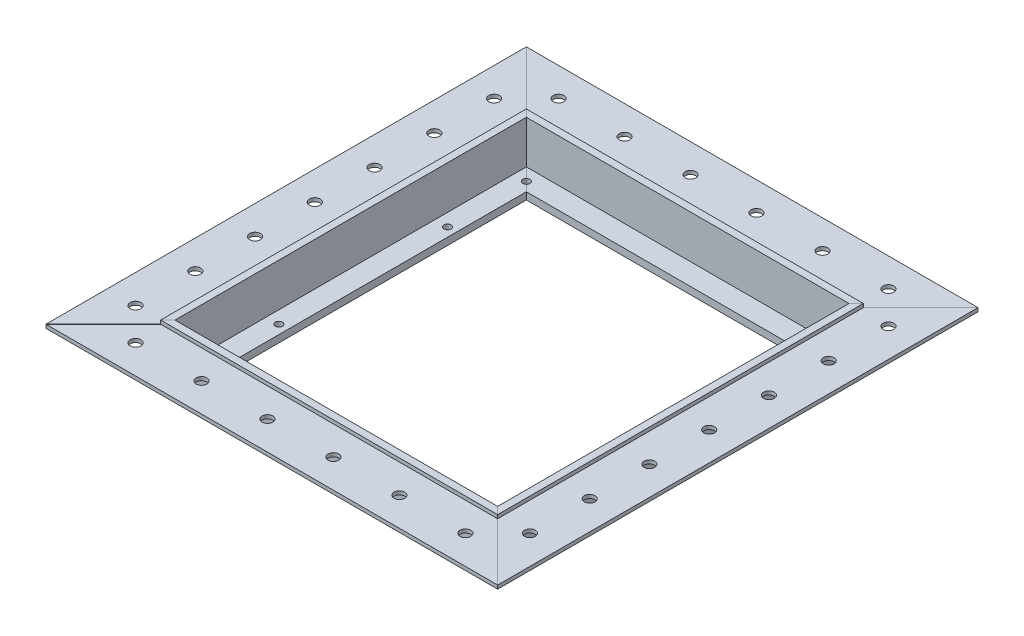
SolidWorks part; units mm, degrees
ref_plane "Front Plane" through (0, 0, 0) normal (0, 0, 1) x (1, 0, 0)
ref_plane "Top Plane" through (0, 0, 0) normal (0, 1, 0) x (1, 0, 0)
ref_plane "Right Plane" through (0, 0, 0) normal (1, 0, 0) x (0, 0, -1)
sketch "Sketch1" plane through (0, 0, 0) normal (0, 0, 1) x (1, 0, 0)
  line L0 (0, 0) -> (-12.7, 0)
  line L1 (-12.7, 0) -> (-12.7, 19.05)
  line L2 (-12.7, 19.05) -> (-38.1, 19.05)
  line L3 (-38.1, 19.05) -> (-38.1, 20.6375)
  line L4 (-38.1, 20.6375) -> (-12.7, 20.6375)
  line L5 (-12.7, 20.6375) -> (-12.7, 22.225)
  line L6 (-12.7, 22.225) -> (-9.525, 22.225)
  line L7 (-9.525, 22.225) -> (-9.525, 3.175)
  line L8 (-9.525, 3.175) -> (0, 3.175)
  line L9 (0, 3.175) -> (0, 0)
  line L10 (0, 0) -> (0.1482, 0.0676)
  line L11 (-9.525, 22.225) -> (133.35, 22.225) construction
  line L12 (61.9125, 22.225) -> (61.9125, -3.6466) construction
  line L13 (123.825, 0) -> (123.6768, 0.0676)
  line L14 (123.825, 3.175) -> (123.825, 0)
  line L15 (133.35, 3.175) -> (123.825, 3.175)
  line L16 (133.35, 22.225) -> (133.35, 3.175)
  line L17 (136.525, 22.225) -> (133.35, 22.225)
  line L18 (136.525, 20.6375) -> (136.525, 22.225)
  line L19 (161.925, 20.6375) -> (136.525, 20.6375)
  line L20 (161.925, 19.05) -> (161.925, 20.6375)
  line L21 (136.525, 19.05) -> (161.925, 19.05)
  line L22 (136.525, 0) -> (136.525, 19.05)
  line L23 (123.825, 0) -> (136.525, 0)
  dimension "D1" = 12.7
  dimension "D2" = 19.05
  dimension "D3" = 25.4
  dimension "D4" = 1.5875
  dimension "D5" = 22.225
  dimension "D6" = 3.175
  dimension "D7" = 3.175
  dimension "D8" = 142.875
sketch "Sketch2" plane through (0, 0, 0) normal (0, 1, 0) x (1, 0, 0)
  line L0 (-9.525, 0) -> (133.35, 0) construction
  line L1 (150.8125, -47.625) -> (-26.9875, -47.625)
  line L2 (150.8125, -47.625) -> (150.8125, 47.625)
  line L3 (150.8125, 47.625) -> (-26.9875, 47.625)
  line L4 (-26.9875, -47.625) -> (-26.9875, 47.625)
  line L5 (150.8125, -47.625) -> (-26.9875, 47.625) construction
  line L6 (150.8125, 47.625) -> (-26.9875, -47.625) construction
  point P0 (61.9125, 0)
  dimension "D1" = 177.8
  dimension "D2" = 95.25
extrude "Boss-Extrude1" add sketch "Sketch1" along normal mid plane 155.575 contours L14 L23 L22 L21 L20 L19 L18 L17 L16 L15 | L0 L1 L2 L3 L4 L5 L6 L7 L8 L9
ref_plane "Plane2" through (61.9125, 0, 0) normal (-1, 0, 0) x (0, 0, 1)
sketch "Sketch3" plane through (61.9125, 0, 0) normal (-1, 0, 0) x (0, 0, 1)
  line L0 (-68.2625, 0) -> (-80.9625, 0)
  line L1 (-80.9625, 0) -> (-80.9625, 19.05)
  line L2 (-80.9625, 19.05) -> (-106.3625, 19.05)
  line L3 (-106.3625, 19.05) -> (-106.3625, 20.6375)
  line L4 (-106.3625, 20.6375) -> (-80.9625, 20.6375)
  line L5 (-80.9625, 20.6375) -> (-80.9625, 22.225)
  line L6 (-80.9625, 22.225) -> (-77.7875, 22.225)
  line L7 (-77.7875, 22.225) -> (-77.7875, 3.175)
  line L8 (-77.7875, 3.175) -> (-68.2625, 3.175)
  line L9 (-68.2625, 3.175) -> (-68.2625, 0)
  line L11 (0, 22.225) -> (0, -35.0713) construction
  line L12 (77.7875, 22.225) -> (-77.7875, 22.225) construction
  line L13 (68.2625, 0) -> (68.1143, 0.0676)
  line L14 (68.2625, 3.175) -> (68.2625, 0)
  line L15 (77.7875, 3.175) -> (68.2625, 3.175)
  line L16 (77.7875, 22.225) -> (77.7875, 3.175)
  line L17 (80.9625, 22.225) -> (77.7875, 22.225)
  line L18 (80.9625, 20.6375) -> (80.9625, 22.225)
  line L19 (106.3625, 20.6375) -> (80.9625, 20.6375)
  line L20 (106.3625, 19.05) -> (106.3625, 20.6375)
  line L21 (80.9625, 19.05) -> (106.3625, 19.05)
  line L22 (80.9625, 0) -> (80.9625, 19.05)
  line L23 (68.2625, 0) -> (80.9625, 0)
  dimension "D1" = 12.7
  dimension "D2" = 19.05
  dimension "D3" = 25.4
  dimension "D4" = 1.5875
  dimension "D5" = 22.225
  dimension "D6" = 3.175
  dimension "D7" = 3.175
  dimension "D8" = 77.7875
extrude "Boss-Extrude2" add sketch "Sketch3" along normal mid plane 200.025 contours L9 L8 L7 L6 L5 L4 L3 L2 L1 L0 | L14 L23 L22 L21 L20 L19 L18 L17 L16 L15
sketch "Sketch4" plane through (0, 20.6375, 0) normal (0, 1, 0) x (1, 0, 0)
  line L0 (-38.1, -106.3625) -> (161.925, -106.3625) construction
  line L1 (161.925, 106.3625) -> (136.525, 106.3625)
  line L2 (161.925, 106.3625) -> (161.925, -106.3625)
  line L3 (161.925, -106.3625) -> (136.525, -106.3625)
  line L4 (136.525, 106.3625) -> (136.525, -106.3625)
  line L5 (-38.1, 106.3625) -> (161.925, 106.3625) construction
  line L6 (-38.1, -106.3625) -> (-12.7, -106.3625)
  line L7 (-38.1, -106.3625) -> (-38.1, 106.3625)
  line L8 (-38.1, 106.3625) -> (-12.7, 106.3625)
  line L9 (-12.7, -106.3625) -> (-12.7, 106.3625)
  line L10 (136.525, -77.7875) -> (136.525, 77.7875) construction
  line L11 (161.925, -77.7875) -> (161.925, 77.7875) construction
  line L12 (-38.1, -106.3625) -> (161.925, -106.3625) construction
  line L13 (-12.7, -77.7875) -> (-12.7, 77.7875) construction
  line L14 (-38.1, 106.3625) -> (161.925, 106.3625) construction
  line L15 (-38.1, -77.7875) -> (-38.1, 77.7875) construction
  point P14 (120.65, 117.475)
  point P19 (0, 0)
extrude "Cut-Extrude1" cut sketch "Sketch4" along normal blind 158.75
sketch "Sketch5" plane through (0, 0, 80.9625) normal (0, 0, 1) x (1, 0, 0)
  line L1 (-38.1, 19.05) -> (-12.7, 19.05)
  line L2 (-38.1, 19.05) -> (-38.1, 0)
  line L3 (-38.1, 0) -> (-12.7, 0)
  line L4 (-12.7, 19.05) -> (-12.7, 0)
  line L5 (136.525, 0) -> (161.925, 0)
  line L6 (136.525, 0) -> (136.525, 19.05)
  line L7 (136.525, 19.05) -> (161.925, 19.05)
  line L8 (161.925, 0) -> (161.925, 19.05)
extrude "Cut-Extrude2" cut sketch "Sketch5" against normal through all
sketch "Sketch14" plane through (0, 22.225, 0) normal (0, 1, 0) x (1, 0, 0)
  line L0 (-9.525, -77.7875) -> (133.35, -77.7875) construction
  line L1 (133.35, -77.7875) -> (133.35, 77.7875) construction
  line L2 (-9.525, 77.7875) -> (133.35, 77.7875) construction
  line L3 (-9.525, -77.7875) -> (-9.525, 77.7875) construction
  line L4 (-12.7, 80.9625) -> (-12.7, -80.9625)
  line L5 (-12.7, -80.9625) -> (136.525, -80.9625)
  line L6 (136.525, -80.9625) -> (136.525, 80.9625)
  line L7 (136.525, 80.9625) -> (-12.7, 80.9625)
  line L8 (-12.7, 80.9625) -> (-12.7, -80.9625)
  line L9 (-12.7, -80.9625) -> (136.525, -80.9625)
  line L10 (136.525, -80.9625) -> (136.525, 80.9625)
  line L11 (136.525, 80.9625) -> (-12.7, 80.9625)
  line L12 (-9.525, -77.7875) -> (133.35, -77.7875)
  line L13 (133.35, -77.7875) -> (133.35, 77.7875)
  line L14 (-9.525, 77.7875) -> (133.35, 77.7875)
  line L15 (-9.525, -77.7875) -> (-9.525, 77.7875)
  line L16 (-11.1125, -79.375) -> (-11.1125, 79.375)
  line L17 (-11.1125, 79.375) -> (134.9375, 79.375)
  line L18 (134.9375, -79.375) -> (134.9375, 79.375)
  line L19 (-11.1125, -79.375) -> (134.9375, -79.375)
  dimension "D2" = 1.5875
  dimension "D1" = 0
sketch "Sketch6" plane through (0, 22.225, 0) normal (0, 1, 0) x (1, 0, 0)
  line L0 (161.925, 106.3625) -> (123.825, 68.2625) construction
  line L1 (0, 0) -> (186.3821, 0) construction
  line L2 (61.9125, 106.3625) -> (61.9125, 211.7305) construction
  line L3 (-38.1, 106.3625) -> (161.925, 106.3625) construction
  line L4 (161.907, 106.3805) -> (114.639, 59.1124)
  line L5 (161.943, 106.3445) -> (115.0327, 59.4343)
  line L6 (114.639, 59.1124) -> (115.0327, 59.4343)
  line L7 (161.907, 106.3805) -> (123.807, 68.2805) construction
  line L8 (161.943, 106.3445) -> (123.843, 68.2445) construction
  line L9 (161.907, 106.3805) -> (161.943, 106.3445)
  line L10 (-38.1, 106.3625) -> (0, 68.2625) construction
  line L11 (-38.082, 106.3805) -> (-38.118, 106.3445)
  line L12 (9.186, 59.1124) -> (8.7923, 59.4343)
  line L13 (-38.118, 106.3445) -> (8.7923, 59.4343)
  line L14 (-38.082, 106.3805) -> (9.186, 59.1124)
  line L15 (-38.1, -106.3625) -> (0, -68.2625) construction
  line L16 (61.9125, -106.3625) -> (61.9125, -211.7305) construction
  line L17 (161.925, -106.3625) -> (123.825, -68.2625) construction
  line L18 (-38.082, -106.3805) -> (9.186, -59.1124)
  line L19 (-38.118, -106.3445) -> (8.7923, -59.4343)
  line L20 (9.186, -59.1124) -> (8.7923, -59.4343)
  line L21 (-38.082, -106.3805) -> (-38.118, -106.3445)
  line L22 (161.907, -106.3805) -> (161.943, -106.3445)
  line L23 (114.639, -59.1124) -> (115.0327, -59.4343)
  line L24 (161.943, -106.3445) -> (115.0327, -59.4343)
  line L25 (161.907, -106.3805) -> (114.639, -59.1124)
  dimension "D3" = 1.27
  dimension "D4" = 0.5085
  dimension "D1" = 0.0254
  dimension "D2" = 0.0254
extrude "Cut-Extrude3" cut sketch "Sketch6" against normal through all
sketch "Sketch7" plane through (0, 20.6375, 0) normal (0, 1, 0) x (1, 0, 0)
  line L0 (-38.1, 106.3266) -> (-38.1, 106.3625) construction
  line L1 (-38.1, 106.3625) -> (-38.0641, 106.3625) construction
  line L2 (161.8891, -106.3625) -> (161.925, -106.3625) construction
  line L3 (161.925, -106.3266) -> (161.925, -106.3625) construction
  line L4 (149.225, 93.6625) -> (-25.4, 93.6625) construction
  line L5 (161.925, -106.3625) -> (-38.1, -106.3625) construction
  line L6 (161.925, -106.3625) -> (161.925, 106.3625) construction
  line L7 (161.925, 106.3625) -> (-38.1, 106.3625) construction
  line L8 (-38.1, -106.3625) -> (-38.1, 106.3625) construction
  line L9 (-25.4, -93.6625) -> (-25.4, 93.6625) construction
  line L10 (149.225, -93.6625) -> (-25.4, -93.6625) construction
  line L11 (149.225, -93.6625) -> (149.225, 93.6625) construction
  line L12 (-12.7, 75.2116) -> (-9.525, 75.2116) construction
  line L13 (-12.7, -80.9266) -> (-12.7, 80.9266) construction
  line L14 (-9.525, -77.7516) -> (-9.525, 77.7516) construction
  line L15 (-6.9491, 80.9625) -> (-6.9491, 77.7875) construction
  line L16 (-12.6641, 80.9625) -> (136.4891, 80.9625) construction
  line L17 (133.3141, 77.7875) -> (-9.4891, 77.7875) construction
  line L18 (61.9125, 106.3625) -> (61.9125, -106.3625) construction
  line L19 (-38.1, 0) -> (161.925, 0) construction
  line L20 (-11.1125, 75.2116) -> (-11.1125, 93.6625) construction
  line L21 (-6.9491, 79.375) -> (-25.4, 79.375) construction
  line L22 (130.7741, 80.9625) -> (130.7741, 77.7875) construction
  line L23 (136.525, 75.2116) -> (133.35, 75.2116) construction
  line L24 (130.7741, 79.375) -> (149.225, 79.375) construction
  line L25 (134.9375, 75.2116) -> (134.9375, 93.6625) construction
  circle A0 centre (-11.1125, 93.6625) radius 2.3749 construction
  circle A1 centre (-25.4, 79.375) radius 2.3813
  dimension "D4" = 4.7498
  dimension "D5" = 4.7625
  dimension "D6" = 146.05
  dimension "D2" = 2.54
  dimension "D3" = 2.54
  dimension "D1" = 12.7
extrude "Cut-Extrude4" cut sketch "Sketch7" against normal blind 2.54
pattern_linear "LPattern1" count 7 spacing 26.4583 along (0, 0, 1) of "Cut-Extrude4"
sketch "Sketch8" plane through (0, 20.6375, 0) normal (0, 1, 0) x (1, 0, 0)
  circle A0 centre (-11.1125, 93.6625) radius 2.3749
extrude "Cut-Extrude5" cut sketch "Sketch8" against normal blind 2.54
pattern_linear "LPattern2" count 6 spacing 29.21 along (1, 0, 0) of "Cut-Extrude5"
ref_plane "Plane3" through (0, 0, 0) normal (0, 0, -1) x (-1, 0, 0)
sketch "Sketch9" plane through (0, 20.6375, 0) normal (0, 1, 0) x (1, 0, 0)
  line L0 (61.9125, 106.3625) -> (61.9125, -106.3625) construction
  line L3 (-38.0641, 106.3625) -> (161.8891, 106.3625) construction
  line L6 (-38.0641, -106.3625) -> (161.8891, -106.3625) construction
  line L7 (-38.1, 0) -> (161.925, 0) construction
  line L8 (-38.1, 106.3266) -> (-38.1, -106.3266) construction
  line L9 (161.925, -106.3266) -> (161.925, 106.3266) construction
  circle A5 centre (134.9375, 93.6625) radius 2.3749 construction
  circle A6 centre (105.7275, 93.6625) radius 2.3749 construction
  circle A7 centre (76.5175, 93.6625) radius 2.3749 construction
  circle A8 centre (47.3075, 93.6625) radius 2.3749 construction
  circle A9 centre (18.0975, 93.6625) radius 2.3749 construction
  circle A18 centre (-11.1125, 93.6625) radius 2.3749 construction
  circle A19 centre (134.9375, 93.6625) radius 2.3749 construction
  circle A20 centre (105.7275, 93.6625) radius 2.3749 construction
  circle A21 centre (76.5175, 93.6625) radius 2.3749 construction
  circle A22 centre (47.3075, 93.6625) radius 2.3749 construction
  circle A23 centre (18.0975, 93.6625) radius 2.3749 construction
  circle A24 centre (-11.1125, 93.6625) radius 2.3749 construction
  circle A25 centre (-11.1125, -93.6625) radius 2.3749
  circle A26 centre (18.0975, -93.6625) radius 2.3749
  circle A27 centre (47.3075, -93.6625) radius 2.3749
  circle A28 centre (76.5175, -93.6625) radius 2.3749
  circle A29 centre (105.7275, -93.6625) radius 2.3749
  circle A30 centre (134.9375, -93.6625) radius 2.3749
  circle A31 centre (-25.4, -79.375) radius 2.3813 construction
  circle A32 centre (-25.4, -52.9167) radius 2.3813 construction
  circle A33 centre (-25.4, -26.4583) radius 2.3813 construction
  circle A34 centre (-25.4, 0) radius 2.3813 construction
  circle A35 centre (-25.4, 26.4583) radius 2.3813 construction
  circle A36 centre (-25.4, 52.9167) radius 2.3813 construction
  circle A37 centre (-25.4, 79.375) radius 2.3813 construction
  circle A38 centre (-25.4, -79.375) radius 2.3813 construction
  circle A39 centre (-25.4, -52.9167) radius 2.3813 construction
  circle A40 centre (-25.4, -26.4583) radius 2.3813 construction
  circle A41 centre (-25.4, 0) radius 2.3813 construction
  circle A42 centre (-25.4, 26.4583) radius 2.3813 construction
  circle A43 centre (-25.4, 52.9167) radius 2.3813 construction
  circle A44 centre (-25.4, 79.375) radius 2.3813 construction
  circle A45 centre (149.225, 79.375) radius 2.3813
  circle A46 centre (149.225, 52.9167) radius 2.3813
  circle A47 centre (149.225, 26.4583) radius 2.3813
  circle A48 centre (149.225, 0) radius 2.3812
  circle A49 centre (149.225, -26.4583) radius 2.3812
  circle A50 centre (149.225, -52.9167) radius 2.3812
  circle A51 centre (149.225, -79.375) radius 2.3813
extrude "Cut-Extrude6" cut sketch "Sketch9" against normal blind 2.54
sketch "Sketch16" plane through (0, 3.175, 0) normal (0, 1, 0) x (1, 0, 0)
  line L0 (-9.4891, -77.7875) -> (133.3141, -77.7875) construction
  line L1 (-9.525, -77.7516) -> (-9.525, 77.7516) construction
  circle A0 centre (-3.9688, 72.2312) radius 1.5875 construction
  circle A1 centre (-3.9688, 72.2312) radius 1.5875
  circle A2 centre (127.7937, 72.2312) radius 1.5875 construction
  circle A3 centre (127.7937, 72.2312) radius 1.5875
  circle A4 centre (127.7937, -72.2312) radius 1.5875 construction
  circle A5 centre (127.7937, -72.2312) radius 1.5875
  circle A7 centre (-3.9688, -72.2312) radius 1.5875
  circle A8 centre (-3.9688, 37.3062) radius 1.5875 construction
  circle A9 centre (-3.9688, 37.3062) radius 1.5875
  circle A10 centre (-3.9688, -37.3062) radius 1.5875 construction
  circle A11 centre (-3.9688, -37.3062) radius 1.5875
  circle A12 centre (127.7937, -37.3062) radius 1.5875 construction
  circle A13 centre (127.7937, -37.3062) radius 1.5875
  circle A14 centre (127.7937, 37.3062) radius 1.5875 construction
  circle A15 centre (127.7937, 37.3062) radius 1.5875
  dimension "D1" = 5.5563
  dimension "D3" = 3.175
  dimension "D2" = 5.5562
extrude "Cut-Extrude7" cut sketch "Sketch16" against normal through all
